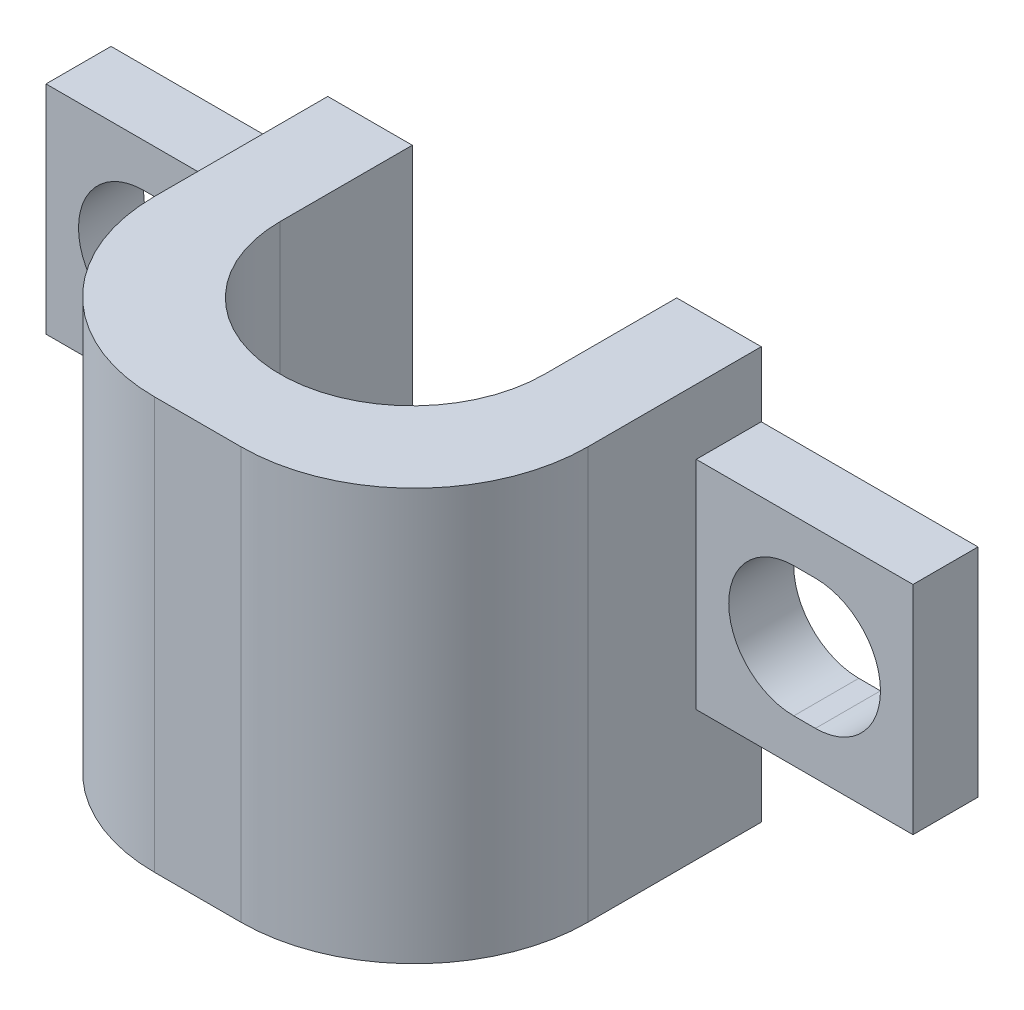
SolidWorks part; units mm, degrees
ref_plane "Front Plane" through (0, 0, 0) normal (0, 0, 1) x (1, 0, 0)
ref_plane "Top Plane" through (0, 0, 0) normal (0, 1, 0) x (1, 0, 0)
ref_plane "Right Plane" through (0, 0, 0) normal (1, 0, 0) x (0, 0, -1)
sketch "Sketch1" plane through (0, 0, 0) normal (0, 1, 0) x (1, 0, 0)
  line L5 (-3.05, 0) -> (-3.05, 3.05)
  line L6 (-5, 3.05) -> (-3.05, 3.05)
  line L7 (-5, 3.05) -> (-5, -0.95)
  line L8 (-1, -4.95) -> (1, -4.95)
  line L9 (5, 3.05) -> (5, -0.95)
  line L10 (3.05, 0) -> (3.05, 3.05)
  line L11 (3.05, 3.05) -> (5, 3.05)
  arc A5 (-3.05, 0) -> (3.05, 0) centre (0, 0) ccw
  arc A6 (-5, -0.95) -> (-1, -4.95) centre (-1, -0.95) ccw
  arc A7 (1, -4.95) -> (5, -0.95) centre (1, -0.95) ccw
  point P14 (-5, -4.95)
  point P17 (5, -4.95)
  dimension "D1" = 6.1
  dimension "D2" = 8
  dimension "D3" = 10
  dimension "D4" = 4
  dimension "D5" = 4
extrude "Boss-Extrude1" add sketch "Sketch1" along normal blind 8
sketch "Sketch2" plane through (0, 0, -3.05) normal (0, 0, -1) x (-1, 0, 0)
  line L1 (-10, 6.5) -> (-5, 6.5)
  line L2 (-10, 6.5) -> (-10, 1.5)
  line L3 (-10, 1.5) -> (-5, 1.5)
  line L4 (-5, 6.5) -> (-5, 1.5)
  line L5 (-7.75, 4) -> (-7.25, 4) construction
  line L6 (-7.75, 5.5) -> (-7.25, 5.5)
  line L7 (-7.75, 2.5) -> (-7.25, 2.5)
  line L8 (-5, 8) -> (-5, 0) construction
  arc A0 (-7.75, 5.5) -> (-7.75, 2.5) centre (-7.75, 4) ccw
  arc A1 (-7.25, 2.5) -> (-7.25, 5.5) centre (-7.25, 4) ccw
  point P8 (-7.5, 4)
  point P13 (-5, 4)
  point P14 (-5, 4)
  point P15 (-7.5, 6.5)
  point P16 (-10, 4)
  dimension "D4" = 1.5
  dimension "D1" = 5
  dimension "D2" = 5
  dimension "D3" = 0.5
extrude "Boss-Extrude2" add sketch "Sketch2" against normal blind 1.5
mirror "Mirror1" about plane through (0, 0, 0) normal (1, 0, 0) of "Boss-Extrude2"
sketch "Sketch3" plane through (0, 0, 0) normal (0, -1, 0) x (1, 0, 0)
  line L0 (-2, 0) -> (-2, -3.05)
  line L1 (-2, -3.05) -> (-5, -3.05)
  line L2 (2, 0) -> (2, -3.05)
  line L3 (2, -3.05) -> (5, -3.05)
  line L7 (-5, 0.95) -> (-5, -3.05)
  line L8 (-5, -3.05) -> (-3.05, -3.05)
  line L9 (-3.05, -3.05) -> (-3.05, 0)
  line L10 (3.05, 0) -> (3.05, -3.05)
  line L11 (3.05, -3.05) -> (5, -3.05)
  line L12 (5, -3.05) -> (5, 0.95)
  line L13 (1, 4.95) -> (-1, 4.95)
  line L14 (-5, 0.95) -> (-5, -3.05)
  line L19 (5, -3.05) -> (5, 0.95)
  line L20 (1, 4.95) -> (-1, 4.95)
  arc A0 (2, 0) -> (-2, 0) centre (0, 0) ccw
  arc A3 (3.05, 0) -> (-3.05, 0) centre (0, 0) ccw
  arc A4 (5, 0.95) -> (1, 4.95) centre (1, 0.95) ccw
  arc A5 (-1, 4.95) -> (-5, 0.95) centre (-1, 0.95) ccw
  arc A7 (5, 0.95) -> (1, 4.95) centre (1, 0.95) ccw
  arc A8 (-1, 4.95) -> (-5, 0.95) centre (-1, 0.95) ccw
  dimension "D2" = 4
  dimension "D1" = 0
extrude "Boss-Extrude3" add sketch "Sketch3" along normal blind 1.5
